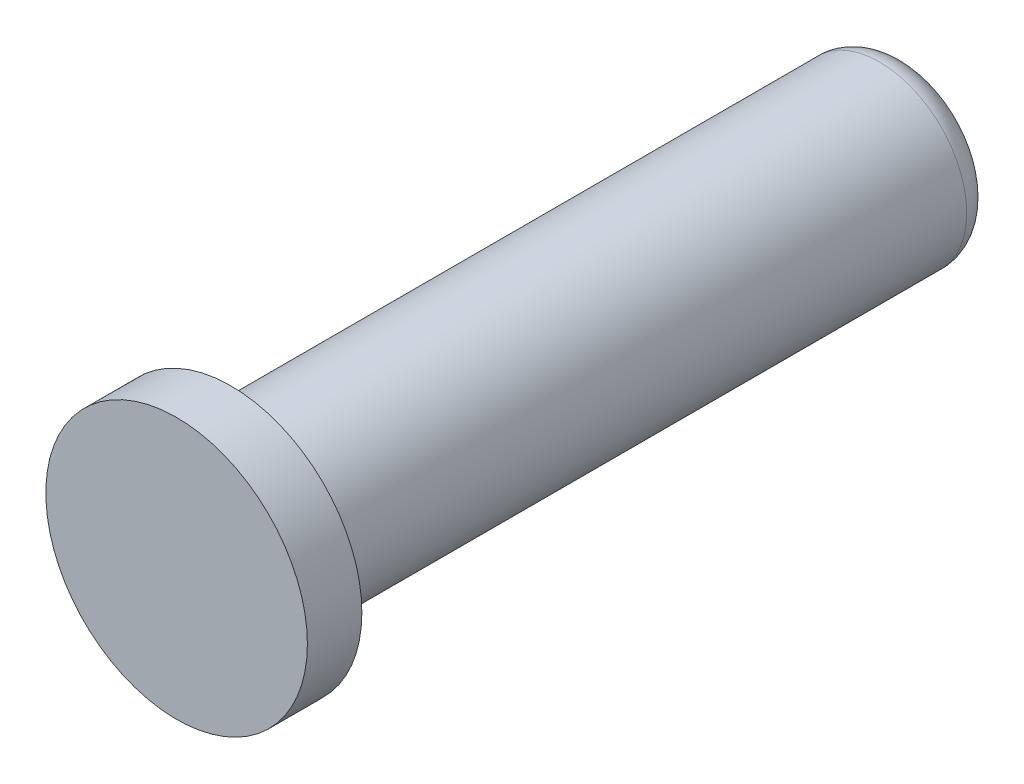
SolidWorks part; units mm, degrees
ref_plane "Front Plane" through (0, 0, 0) normal (0, 0, 1) x (1, 0, 0)
ref_plane "Top Plane" through (0, 0, 0) normal (0, 1, 0) x (1, 0, 0)
ref_plane "Right Plane" through (0, 0, 0) normal (1, 0, 0) x (0, 0, -1)
sketch "Sketch1" plane through (0, 0, 0) normal (1, 0, 0) x (0, 0, -1)
  line L0 (0, 0) -> (55.7131, 0) construction
  line L1 (0, 0) -> (0, 12)
  line L2 (0, 12) -> (5, 12)
  line L3 (5, 12) -> (5, 8)
  line L4 (5, 8) -> (64.5, 8)
  line L5 (67, 5.5) -> (67, 0)
  line L6 (0, 0) -> (67, 0)
  arc A0 (64.5, 8) -> (67, 5.5) centre (64.5, 5.5) cw
  point P10 (67, 8)
  dimension "D5" = 2.5
  dimension "D1" = 5
  dimension "D2" = 12
  dimension "D3" = 8
  dimension "D4" = 62
revolve "Revolve1" add sketch "Sketch1" angle 360 about L0
sketch "Sketch3" plane through (0, 0, 0) normal (1, 0, 0) x (0, 0, -1)
  line L0 (67, 0) -> (59.9899, 0) construction
  line L1 (67, -8) -> (67, 8) construction
  line L2 (67, 3) -> (67, 0)
  line L3 (66.5, 2.5) -> (61, 2.5)
  line L4 (61, 2.5) -> (59.9899, 0)
  line L5 (66.5, 2.5) -> (67, 3)
  line L6 (67, 0) -> (59.9899, 0)
  dimension "D1" = 68
  dimension "D2" = 45
  dimension "D3" = 2.5
  dimension "D4" = 0.5
  dimension "D5" = 6
revolve "Cut-Revolve1" cut sketch "Sketch3" angle 360 about L0
